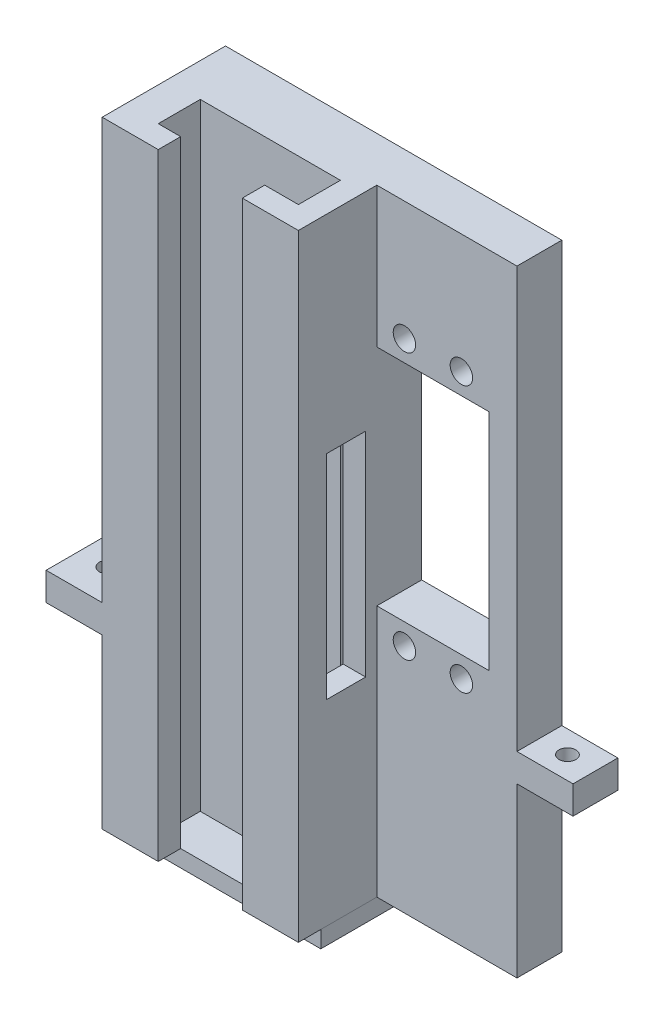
SolidWorks part; units mm, degrees
ref_plane "Front Plane" through (0, 0, 0) normal (0, 0, 1) x (1, 0, 0)
ref_plane "Top Plane" through (0, 0, 0) normal (0, 1, 0) x (1, 0, 0)
ref_plane "Right Plane" through (0, 0, 0) normal (1, 0, 0) x (0, 0, -1)
sketch "Sketch1" plane through (0, 0, 0) normal (0, 1, 0) x (1, 0, 0)
  line L0 (7.5, -10) -> (13.5, -10)
  line L1 (13.5, -10) -> (13.5, 0)
  line L3 (-13.5, 0) -> (-13.5, -10)
  line L4 (-13.5, -10) -> (-7.5, -10)
  line L5 (0, 9.5474) -> (0, -21.2556) construction
  line L11 (7.5, -10) -> (7.5, -14)
  line L12 (-7.5, -10) -> (-7.5, -14)
  line L13 (-13.5, 0) -> (13.5, 0)
  line L14 (7.5, -14) -> (17.5, -14)
  line L15 (17.5, -14) -> (17.5, 8)
  line L16 (17.5, 8) -> (-17.5, 8)
  line L17 (-17.5, 8) -> (-17.5, -14)
  line L18 (-17.5, -14) -> (-7.5, -14)
  dimension "D1" = 27
  dimension "D2" = 10
  dimension "D3" = 6
  dimension "D4" = 4
  dimension "D5" = 4
  dimension "D6" = 22
extrude "Boss-Extrude1" add sketch "Sketch1" along normal blind 40 and the other way blind 70
sketch "Sketch2" plane through (17.5, 0, 0) normal (1, 0, 0) x (0, 0, -1)
  line L1 (-9, 3) -> (-2, 3)
  line L2 (-9, 3) -> (-9, -35)
  line L3 (-9, -35) -> (-2, -35)
  line L4 (-2, 3) -> (-2, -35)
  line L9 (-14, -70) -> (-14, 40) construction
  line L10 (-14, -70) -> (8, -70) construction
  dimension "D1" = 7
  dimension "D2" = 38
  dimension "D3" = 5
  dimension "D4" = 35
ref_plane "Plane3" through (2.5, 0, 0) normal (1, 0, 0) x (0, 0, -1)
extrude "Cut-Extrude6" cut sketch "Sketch2" against normal blind 30
sketch "Sketch10" plane through (0, 0, -8) normal (0, 0, -1) x (-1, 0, 0)
  line L4 (-42.5, 40) -> (-42.5, -70)
  line L7 (-42.5, 40) -> (-17.5, 40)
  line L8 (-17.5, -70) -> (-17.5, 40) construction
  line L9 (-17.5, 40) -> (17.5, 40) construction
  line L10 (-17.5, 40) -> (-17.5, -70)
  line L11 (-17.5, -70) -> (-42.5, -70)
  dimension "D1" = 25
extrude "Boss-Extrude3" add sketch "Sketch10" against normal up to surface (8 mm away)
sketch "Sketch11" plane through (0, 0, -8) normal (0, 0, -1) x (-1, 0, 0)
  line L0 (-42.5, 40) -> (-42.5, -70) construction
  line L1 (-37.5, 15) -> (-17.5, 15)
  line L2 (-37.5, 15) -> (-37.5, -25)
  line L3 (-37.5, -25) -> (-17.5, -25)
  line L4 (-17.5, 15) -> (-17.5, -25)
  line L6 (-42.5, -70) -> (-17.5, -70) construction
  dimension "D1" = 20
  dimension "D2" = 40
  dimension "D3" = 5
  dimension "D4" = 45
extrude "Cut-Extrude9" cut sketch "Sketch11" against normal up to surface (10 mm away)
sketch "Sketch12" plane through (17.5, 0, 0) normal (1, 0, 0) x (0, 0, -1)
  line L1 (0, -25) -> (-2, -25)
  line L3 (0, 15) -> (-2, 15)
  line L6 (-2, -25) -> (-2, 15)
  line L7 (-2, -35) -> (-2, 3) construction
  line L8 (0, -25) -> (0, 15)
  line L9 (0, 40) -> (0, -70) construction
  line L10 (0, 15) -> (8, 15) construction
  line L11 (8, -25) -> (0, -25) construction
extrude "Cut-Extrude10" [suppressed] cut sketch "Sketch12" against normal up to surface (4 mm away)
sketch "Sketch13" plane through (0, 40, 0) normal (0, 1, 0) x (1, 0, 0)
  line L0 (-11.5, -10) -> (-13.5, -10)
  line L1 (-7.5, -10) -> (-13.5, -10) construction
  line L2 (-13.5, -10) -> (-13.5, 0)
  line L3 (-13.5, 0) -> (13.5, 0)
  line L4 (13.5, 0) -> (13.5, -2.5)
  line L5 (13.5, -2.5) -> (-11.5, -2.5)
  line L6 (-11.5, -2.5) -> (-11.5, -10)
  dimension "D1" = 2.5
  dimension "D2" = 2
extrude "Boss-Extrude4" add sketch "Sketch13" against normal up to surface (110 mm away)
sketch "Sketch14" plane through (0, 0, -8) normal (0, 0, -1) x (-1, 0, 0)
  line L0 (0, -25) -> (0, 25) construction
  line L1 (-2.5, -25) -> (-2.5, 25)
  line L2 (2.5, -25) -> (2.5, 25)
  line L3 (17.5, -70) -> (17.5, 40) construction
  line L4 (-42.5, 40) -> (17.5, 40) construction
  arc A0 (-2.5, -25) -> (2.5, -25) centre (0, -25) ccw
  arc A1 (2.5, 25) -> (-2.5, 25) centre (0, 25) ccw
  point P2 (0, 0)
  dimension "D1" = 2.5
  dimension "D2" = 50
  dimension "D3" = 17.5
  dimension "D4" = 15
extrude "Cut-Extrude11" cut sketch "Sketch14" against normal up to next
sketch "Sketch15" plane through (0, 0, -8) normal (0, 0, -1) x (-1, 0, 0)
  circle A0 centre (-22.42, 18.749) radius 2
  circle A1 centre (-32.58, 18.749) radius 2
  circle A2 centre (-22.42, -28.749) radius 2
  circle A3 centre (-32.58, -28.749) radius 2
  dimension "D1" = 4
extrude "Cut-Extrude12" cut sketch "Sketch15" against normal up to next contours A1
sketch "Sketch16" plane through (0, -70, 0) normal (0, -1, 0) x (1, 0, 0)
  line L0 (-17.5, -8) -> (-17.5, 14) construction
  line L1 (-17.5, 10) -> (17.5, 10)
  line L2 (-17.5, 10) -> (-17.5, -8)
  line L3 (-17.5, -8) -> (17.5, -8)
  line L4 (17.5, 10) -> (17.5, -8)
  line L6 (42.5, -8) -> (-17.5, -8) construction
  line L7 (17.5, 14) -> (17.5, 0) construction
  line L8 (13.5, 10) -> (7.5, 10) construction
extrude "Boss-Extrude5" add sketch "Sketch16" along normal blind 3 separate body
ref_plane "Plane4" through (0, -35, 0) normal (0, -1, 0) x (-1, 0, 0)
sketch "Sketch17" plane through (0, -35, 0) normal (0, -1, 0) x (-1, 0, 0)
  line L0 (17.5, 8) -> (-17.5, 8) construction
  line L1 (17.5, -14) -> (27.5, -14)
  line L2 (17.5, -14) -> (17.5, 8)
  line L3 (17.5, 8) -> (27.5, 8)
  line L4 (27.5, -14) -> (27.5, 8)
  line L5 (-42.5, 0) -> (-52.5, 0)
  line L6 (-42.5, 0) -> (-42.5, 8)
  line L7 (-42.5, 8) -> (-52.5, 8)
  line L8 (-52.5, 0) -> (-52.5, 8)
  line L9 (-42.5, 8) -> (17.5, 8) construction
  line L10 (-42.5, 0) -> (-42.5, 8) construction
  line L11 (17.5, -10) -> (17.5, 8) construction
  line L12 (-42.5, 0) -> (-17.5, 0) construction
  line L13 (17.5, -14) -> (7.5, -14) construction
  line L14 (-52.5, 0) -> (-42.5, 8) construction
  line L15 (-42.5, 0) -> (-52.5, 8) construction
  line L16 (22.5, -8) -> (22.5, 2) construction
  line L17 (17.5, 8) -> (17.5, -14) construction
  line L18 (20.4292, -3) -> (24.9437, -3) construction
  circle A0 centre (22.5, -8) radius 1.5
  circle A1 centre (22.5, 2) radius 1.5
  circle A2 centre (-47.5, 4) radius 1.5
  point P28 (-47.5, 4)
  point P31 (0, 0)
  dimension "D2" = 3
  dimension "D1" = 10
  dimension "D3" = 10
extrude "Boss-Extrude6" add sketch "Sketch17" along normal blind 5
